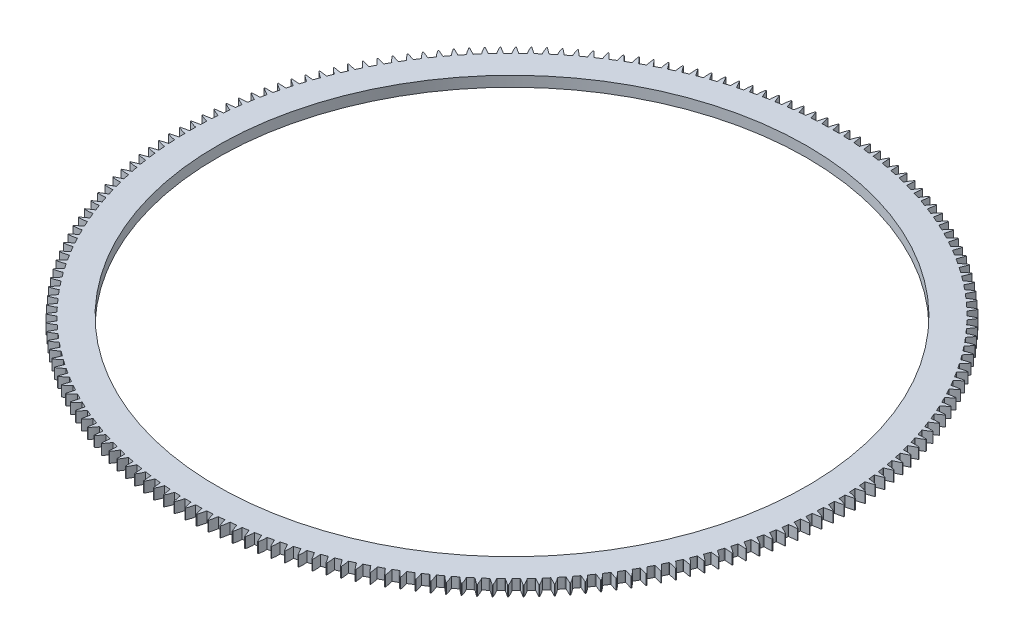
SolidWorks part; units mm, degrees
ref_plane "Front Plane" through (0, 0, 0) normal (0, 0, 1) x (1, 0, 0)
ref_plane "Top Plane" through (0, 0, 0) normal (0, 1, 0) x (1, 0, 0)
ref_plane "Right Plane" through (0, 0, 0) normal (1, 0, 0) x (0, 0, -1)
sketch "Sketch1" plane through (0, 0, 0) normal (0, 1, 0) x (1, 0, 0)
  line L0 (0, 0) -> (0, 45.5029) construction
  line L1 (0, 0) -> (-45.5029, 0) construction
  line L2 (0, 0) -> (-47.4983, -0.3969) construction
  line L3 (0, 0) -> (-45.4966, -0.7603) construction
  line L4 (0, 0) -> (-45.4775, -1.5205) construction
  circle A0 centre (0, 0) radius 47 construction
  circle A1 centre (0, 0) radius 45.5029 construction
  circle A2 centre (0, 0) radius 46.375 construction
  circle A3 centre (0, 0) radius 47.5 construction
  spline S0 degree 4 poles (-45.5029, 0) (-45.5445, 0) (-45.6274, -0.0019) (-45.8599, -0.0173) (-46.2972, -0.072) (-46.9636, -0.2004) (-47.8508, -0.4406) (-48.9752, -0.8302) (-50.2658, -1.3861) (-51.6414, -2.0976) (-53.085, -2.975) (-54.4731, -3.9404) (-55.8048, -4.9821) (-57.0806, -6.0914) (-58.5615, -7.5108) (-60.2445, -9.3251) (-62.0656, -11.58) (-63.9503, -14.3144) (-65.6642, -17.2305) (-67.1771, -20.2556) (-68.3294, -22.981) (-69.1978, -25.3636) (-69.8433, -27.3748) (-70.3136, -28.999) (-70.7383, -30.6333) (-71.118, -32.2829) (-71.4532, -33.9349) (-71.7449, -35.607) (-71.993, -37.2665) (-72.1992, -38.9645) (-72.3622, -40.6109) (-72.4707, -42.1456) (-72.5347, -43.3168) (-72.5754, -44.4837) (-72.5909, -45.0936) (-72.6044, -45.9372) (-72.6066, -46.5889) (-72.604, -47.3183) (-72.5936, -48.0033) (-72.5772, -48.7157) (-72.5536, -49.4088) (-72.5312, -49.9409) (-72.514, -50.2876) (-72.5049, -50.4643) knots 0 0 0 0 0 0.002688 0.005377 0.015084 0.028532 0.04661 0.064855 0.092111 0.119476 0.146842 0.174209 0.201575 0.228941 0.256307 0.307035 0.361767 0.4165 0.471232 0.525964 0.580697 0.608063 0.635429 0.662795 0.690161 0.717528 0.744894 0.77226 0.799626 0.826992 0.854358 0.881725 0.895408 0.909091 0.920455 0.931818 0.943182 0.954545 0.965909 0.977273 0.988636 1 1 1 1 1 construction
  spline S1 degree 4 poles (-45.5029, 0) (-45.5445, 0) (-45.6274, -0.0019) (-45.8599, -0.0173) (-46.2972, -0.072) (-46.9636, -0.2004) (-47.8508, -0.4406) (-48.9752, -0.8302) (-50.2658, -1.3861) (-51.6414, -2.0976) (-53.085, -2.975) (-54.4731, -3.9404) (-55.8048, -4.9821) (-57.0806, -6.0914) (-58.5615, -7.5108) (-60.2445, -9.3251) (-62.0656, -11.58) (-63.9503, -14.3144) (-65.6642, -17.2305) (-67.1771, -20.2556) (-68.3294, -22.981) (-69.1978, -25.3636) (-69.8433, -27.3748) (-70.3136, -28.999) (-70.7383, -30.6333) (-71.118, -32.2829) (-71.4532, -33.9349) (-71.7449, -35.607) (-71.993, -37.2665) (-72.1992, -38.9645) (-72.3622, -40.6109) (-72.4707, -42.1456) (-72.5347, -43.3168) (-72.5684, -44.2831) (-72.5793, -44.6603) (-72.584, -44.8522) knots 0 0 0 0 0 0.002688 0.005377 0.015084 0.028532 0.04661 0.064855 0.092111 0.119476 0.146842 0.174209 0.201575 0.228941 0.256307 0.307035 0.361767 0.4165 0.471232 0.525964 0.580697 0.608063 0.635429 0.662795 0.690161 0.717528 0.744894 0.77226 0.799626 0.826992 0.854358 0.881725 0.895408 0.909091 0.909091 0.909091 0.909091 0.909091
  dimension "D1" = 95
  dimension "D2" = 94
  dimension "D3" = 91.0059
  dimension "D4" = 92.75
  dimension "D5" = 45.5029
  dimension "D6" = 0.479
  dimension "D7" = 0.957
  dimension "D8" = 1.915
sketch "Sketch2" plane through (0, 0, 0) normal (0, 1, 0) x (1, 0, 0)
  line L0 (0, 0) -> (-47.4983, -0.3969) construction
  line L1 (0, 0) -> (-47.4983, -0.3969) construction
  line L2 (0, 0) -> (-45.4966, -0.7603) construction
  line L3 (0, 0) -> (-45.5029, 0) construction
  line L4 (0, 0) -> (-45.4775, -1.5205) construction
  line L5 (0, 0) -> (-45.4966, -0.7603) construction
  line L6 (0, 0) -> (-45.5029, 0) construction
  line L7 (0, 0) -> (-45.4775, -1.5205) construction
  line L8 (-46.375, 0) -> (-46.3685, -0.7749) construction
  line L9 (-46.3685, -0.7749) -> (-46.3491, -1.5496)
  line L10 (-46.3491, -1.5496) -> (-45.4775, -1.5205) construction
  line L11 (-46.3491, -1.5496) -> (-1.4992, -0.0501)
  line L12 (-45.5029, 0) -> (-1.5, 0)
  line L13 (-45.5029, 0) -> (-46.375, 0)
  line L14 (-46.375, 0) -> (-46.3742, -0.093)
  circle A0 centre (0, 0) radius 46.375 construction
  circle A1 centre (0, 0) radius 45.5029 construction
  circle A2 centre (0, 0) radius 47 construction
  circle A3 centre (0, 0) radius 47.5 construction
  circle A4 centre (0, 0) radius 46.375 construction
  circle A5 centre (0, 0) radius 45.5029 construction
  circle A6 centre (0, 0) radius 47 construction
  circle A7 centre (0, 0) radius 47.5 construction
  arc A8 (-47.4979, -0.4415) -> (-47.4987, -0.3523) centre (0, 0) cw
  circle A11 centre (0, 0) radius 1.5 construction
  arc A12 (-1.5, 0) -> (-1.4992, -0.0501) centre (0, 0) ccw
  spline S0 degree 4 poles (-12.0839, 999.357) (-39.7793, -35.8653) (-41.3591, -0.8171) (-43.7873, 0.2422) (-46.2972, -0.072) (-46.9636, -0.2004) (-47.8508, -0.4406) (-48.9752, -0.8302) (-50.2658, -1.3861) (-51.6414, -2.0976) (-53.085, -2.975) (-54.4731, -3.9404) (-55.8048, -4.9821) (-57.0806, -6.0914) (-58.5615, -7.5108) (-60.2445, -9.3251) (-62.0656, -11.58) (-63.9503, -14.3144) (-65.6642, -17.2305) (-67.1771, -20.2556) (-68.3294, -22.981) (-69.1978, -25.3636) (-69.8433, -27.3748) (-70.3136, -28.999) (-70.7383, -30.6333) (-71.118, -32.2829) (-71.4532, -33.9349) (-71.7449, -35.607) (-71.993, -37.2665) (-72.1992, -38.9645) (-72.3622, -40.6109) (-72.4707, -42.1456) (-72.6557, -45.5331) (-72.688, -51.2641) (-71.5112, -12.956) (-96.4802, -1044.3948) knots -0.135215 -0.135215 -0.135215 -0.135215 -0.135215 0.002688 0.005377 0.015084 0.028532 0.04661 0.064855 0.092111 0.119476 0.146842 0.174209 0.201575 0.228941 0.256307 0.307035 0.361767 0.4165 0.471232 0.525964 0.580697 0.608063 0.635429 0.662795 0.690161 0.717528 0.744894 0.77226 0.799626 0.826992 0.854358 0.881725 0.895408 1.064456 1.064456 1.064456 1.064456 1.064456 only from (-45.5029, 0) to (-72.584, -44.8522) construction
  spline S1 degree 4 poles (-46.3742, -0.093) (-46.3876, -0.0954) (-46.6054, -0.1336) (-46.8881, -0.1927) (-47.1685, -0.2613) (-47.4338, -0.334) (-47.4987, -0.3523) knots 0.014205 0.014205 0.014205 0.014205 0.014205 0.015084 0.028532 0.032901 0.032901 0.032901 0.032901 0.032901
  spline S2 degree 4 poles (-46.3685, -0.7749) (-46.3761, -0.7737) (-46.4612, -0.7602) (-46.6522, -0.7207) (-46.9374, -0.6449) (-47.2098, -0.5529) (-47.405, -0.4786) (-47.4979, -0.4415) knots 0.004428 0.004428 0.004428 0.004428 0.004428 0.005377 0.015084 0.028532 0.040915 0.040915 0.040915 0.040915 0.040915
  point P18 (-46.3718, -0.3875)
  point P24 (-46.3491, -1.5496)
  dimension "D2" = 3
extrude "Boss-Extrude1" add sketch "Sketch2" along normal blind 1.5
pattern_circular "CirPattern1" count 188 over 360 of "Boss-Extrude1"
sketch "Sketch3" plane through (0, 1.5, 0) normal (0, 1, 0) x (1, 0, 0)
  line L1 (0.5, 0.5) -> (-0.5, 0.5)
  line L2 (0.5, 0.5) -> (0.5, 2.5)
  line L3 (0.5, 2.5) -> (-0.5, 2.5)
  line L4 (-0.5, 0.5) -> (-0.5, 2.5)
  line L5 (0.5, 0.5) -> (-0.5, 2.5) construction
  line L6 (0.5, 2.5) -> (-0.5, 0.5) construction
  circle A0 centre (0, 0) radius 1.5 construction
  point P0 (0, 1.5)
  dimension "D1" = 2
  dimension "D2" = 1
extrude "Cut-Extrude1" cut sketch "Sketch3" against normal up to surface (1.5 mm away)
sketch "Sketch4" plane through (0, 0, 0) normal (0, -1, 0) x (1, 0, 0)
  circle A0 centre (0, 0) radius 42.5
  dimension "D1" = 85
extrude "Cut-Extrude2" cut sketch "Sketch4" against normal up to surface (1.5 mm away)
equation "\"Module\"= .5"
equation "\"Number of Teeth\"= 188"
equation "\"Pressure Angle\"= 14.5deg"
equation "\"Pitch Diameter\"= \"Number of Teeth\" * \"Module\""
equation "\"Circular Pitch\"= pi * \"Module\""
equation "\"Addendum\"= \"Module\""
equation "\"Dedendum\"= 1.25 * \"Module\""
equation "\"Base Diameter\"= \"Pitch Diameter\" * cos ( \"Pressure Angle\" )"
equation "\"Base Radius\"= \"Base Diameter\" / 2"
equation "\"Width\"= 1.5mm"
equation "\"Outside Diameter\"= \"Pitch Diameter\" + 2 * \"Addendum\""
equation "\"D1@Sketch1\"=\"Outside Diameter\""
equation "\"D3@Sketch1\"=\"Base Diameter\""
equation "\"Root Diameter\"= \"Pitch Diameter\" - 2 * \"Dedendum\""
equation "\"D4@Sketch1\"=\"Root Diameter\""
equation "\"Tooth Angle\"= 360 / \"Number of Teeth\""
equation "\"D6@Sketch1\"=\"Tooth Angle\"/4"
equation "\"D7@Sketch1\"=\"Tooth Angle\"/2"
equation "\"D8@Sketch1\"=\"Tooth Angle\""
equation "\"D2@Sketch1\" = \"Pitch Diameter\""
equation "\"Shaft Diameter\"= 3mm"
equation "\"D1@CirPattern1\" = \"Number of Teeth\""
equation "\"D2@Sketch2\"  = \"Shaft Diameter\""
equation "\"D1@Boss-Extrude1\" = \"Width\""
